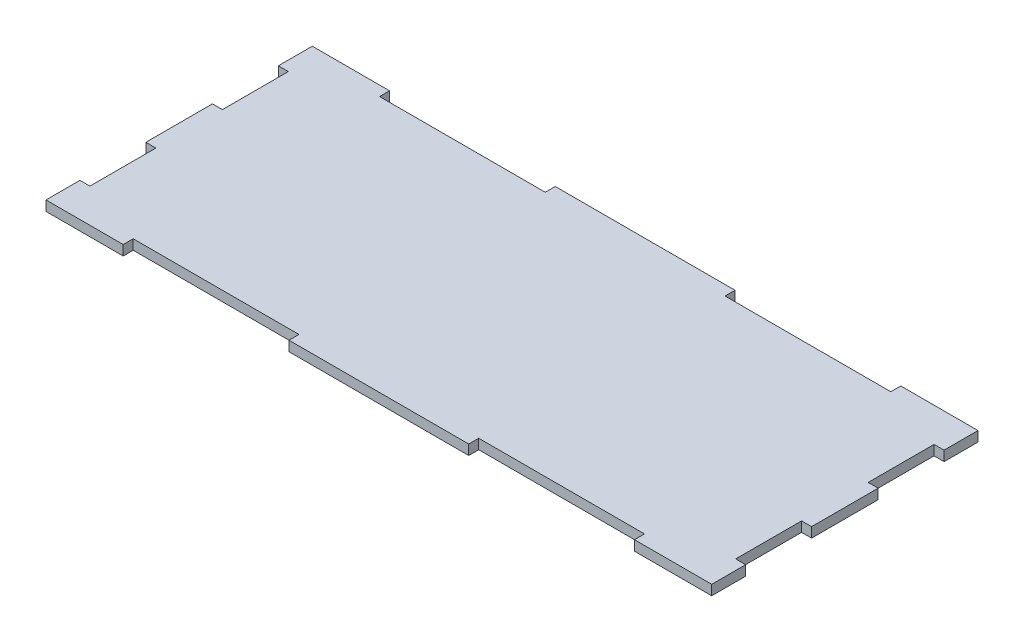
SolidWorks part; units mm, degrees
ref_plane "Front Plane" through (0, 0, 0) normal (0, 0, 1) x (1, 0, 0)
ref_plane "Top Plane" through (0, 0, 0) normal (0, 1, 0) x (1, 0, 0)
ref_plane "Right Plane" through (0, 0, 0) normal (1, 0, 0) x (0, 0, -1)
sketch "Sketch1" plane through (0, 0, 0) normal (0, 0, 1) x (1, 0, 0)
  line L0 (0, 0) -> (200, 0)
  dimension "D1" = 200
extrude "Extrude-Thin1" add sketch "Sketch1" along normal blind 80 thin contours L0
sketch "Sketch2" plane through (0, 0, 0) normal (0, 1, 0) x (1, 0, 0)
  line L0 (0, 0) -> (0, -10.2) construction
  line L1 (0, -80) -> (0, 0) construction
  line L2 (0, -40) -> (200, -40) construction
  line L3 (0, -10.2) -> (3, -10.2)
  line L4 (0, -10.2) -> (0, -30)
  line L5 (0, -30) -> (3, -30)
  line L6 (3, -10.2) -> (3, -30)
  line L7 (200, -80) -> (200, 0) construction
  line L8 (100, 0) -> (100, -80) construction
  line L9 (0, 0) -> (200, 0) construction
  line L10 (0, -80) -> (200, -80) construction
  line L11 (0, -80) -> (0, -69.8) construction
  line L12 (3, -69.8) -> (3, -50)
  line L13 (0, -50) -> (3, -50)
  line L14 (0, -69.8) -> (0, -50)
  line L15 (0, -69.8) -> (3, -69.8)
  line L16 (200, -80) -> (200, -69.8) construction
  line L17 (200, 0) -> (200, -10.2) construction
  line L18 (200, -69.8) -> (197, -69.8)
  line L19 (200, -69.8) -> (200, -50)
  line L20 (200, -50) -> (197, -50)
  line L21 (197, -69.8) -> (197, -50)
  line L22 (197, -10.2) -> (197, -30)
  line L23 (200, -30) -> (197, -30)
  line L24 (200, -10.2) -> (200, -30)
  line L25 (200, -10.2) -> (197, -10.2)
  dimension "D1" = 20
  dimension "D2" = 3
  dimension "D3" = 19.8
extrude "Cut-Extrude1" cut sketch "Sketch2" against normal blind 10
sketch "Sketch3" plane through (0, 0, 0) normal (0, 1, 0) x (1, 0, 0)
  line L0 (100, -80) -> (73, -80) construction
  line L1 (0, -80) -> (200, -80) construction
  line L2 (100, 0) -> (100, -80) construction
  line L3 (73, -80) -> (23.2, -80)
  line L4 (73, -80) -> (73, -77)
  line L5 (73, -77) -> (23.2, -77)
  line L6 (23.2, -80) -> (23.2, -77)
  line L7 (0, 0) -> (200, 0) construction
  line L8 (0, -40) -> (200, -40) construction
  line L9 (0, -50) -> (0, -30) construction
  line L10 (200, -50) -> (200, -30) construction
  line L11 (176.8, -80) -> (176.8, -77)
  line L12 (127, -77) -> (176.8, -77)
  line L13 (127, -80) -> (127, -77)
  line L14 (127, -80) -> (176.8, -80)
  line L15 (100, 0) -> (73, 0) construction
  line L16 (127, 0) -> (176.8, 0)
  line L17 (127, 0) -> (127, -3)
  line L18 (127, -3) -> (176.8, -3)
  line L19 (176.8, 0) -> (176.8, -3)
  line L20 (23.2, 0) -> (23.2, -3)
  line L21 (73, -3) -> (23.2, -3)
  line L22 (73, 0) -> (73, -3)
  line L23 (73, 0) -> (23.2, 0)
  line L24 (0, -30) -> (3, -30) construction
  dimension "D1" = 27
  dimension "D2" = 3
  dimension "D3" = 49.8
  dimension "D4" = 19.8
extrude "Cut-Extrude2" cut sketch "Sketch3" against normal blind 3
